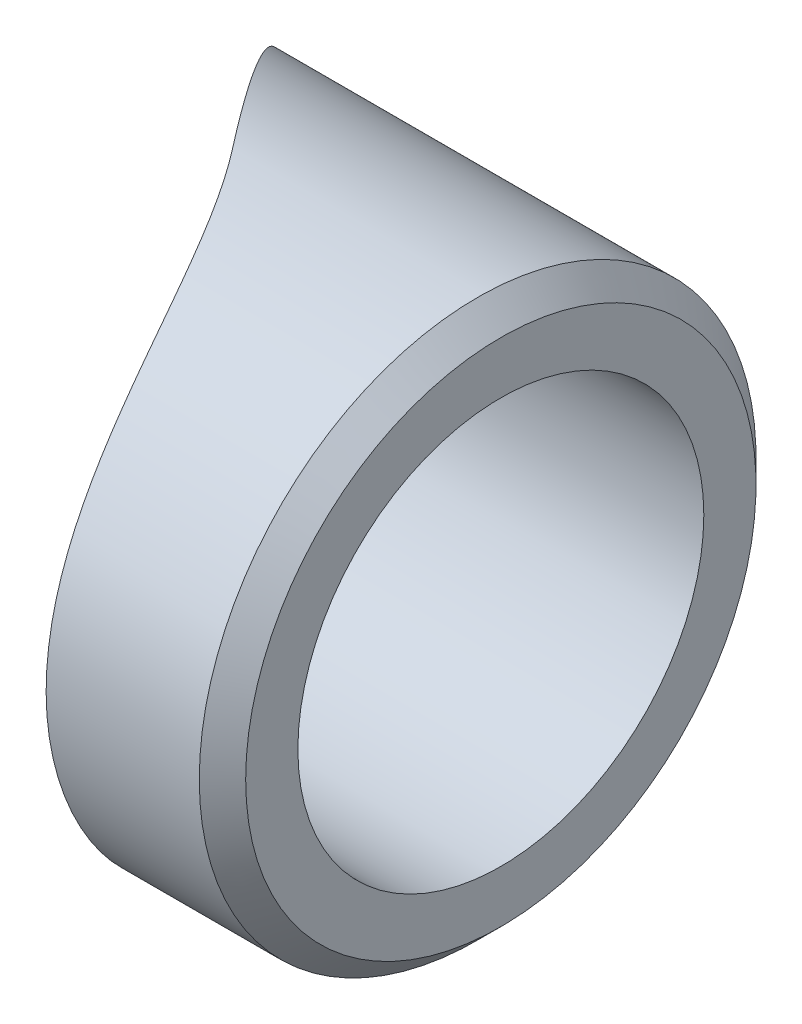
SolidWorks part; units mm, degrees
ref_plane "前视基准面" through (0, 0, 0) normal (0, 0, 1) x (1, 0, 0)
ref_plane "上视基准面" through (0, 0, 0) normal (0, 1, 0) x (1, 0, 0)
ref_plane "右视基准面" through (0, 0, 0) normal (1, 0, 0) x (0, 0, -1)
sketch "草图2" plane through (0, 0, 0) normal (0, 0, 1) x (1, 0, 0)
  line L0 (-186.7903, 0) -> (118.7541, 0) construction
  line L2 (0, 0) -> (21, 0)
  line L3 (0, 0) -> (0, 12)
  line L4 (0, 12) -> (21, 12)
  line L5 (21, 0) -> (21, 12)
  dimension "D1" = 21
  dimension "D2" = 12
revolve "旋转1" add sketch "草图2" angle 360 about L0
hole_wizard "M20 螺纹孔1" positions "草图3" profile "草图5" tap size "M20" standard "GB"
sketch "草图3" plane through (21, 0, 0) normal (1, 0, 0) x (0, 0, -1)
  point P0 (0, 0)
sketch "草图5" plane through (21, 0, 0) normal (0, 1, 0) x (0, 0, -1)
  line L0 (0, 0) -> (0, 21)
  line L1 (0, 21) -> (8.75, 21)
  line L2 (8.75, 21) -> (8.75, 0)
  line L5 (8.75, 0) -> (0, 0)
  line L11 (0, -6.35) -> (0, 107.95) construction
  dimension "通孔螺纹孔钻头直径" = 17.5
  dimension "通孔螺纹孔钻头深度" = 21
chamfer "倒角1" distance 1 angle 45 1 edges at (21, 0, 12)
sketch "草图6" plane through (0, 0, 0) normal (0, 1, 0) x (1, 0, 0)
  line L0 (0, 12) -> (9.1602, 0.2755)
  line L1 (13.4, -12.0378) -> (13.4, -12)
  line L2 (0, -12) -> (20, -12) construction
  line L3 (0, -12) -> (20, -12) construction
  line L4 (21, -11) -> (21, 11) construction
  line L5 (0, 12) -> (0, -12)
  line L6 (0, -12) -> (13.4, -12)
  arc A0 (9.1602, 0.2755) -> (13.4, -12.0378) centre (-6.6, -12.0378) cw
  dimension "D1" = 20
  dimension "D2" = 7.6
  dimension "D3" = 52
extrude "切除-拉伸1" cut sketch "草图6" against normal through all both and the other way through all contours A0 L0 L5 L6
